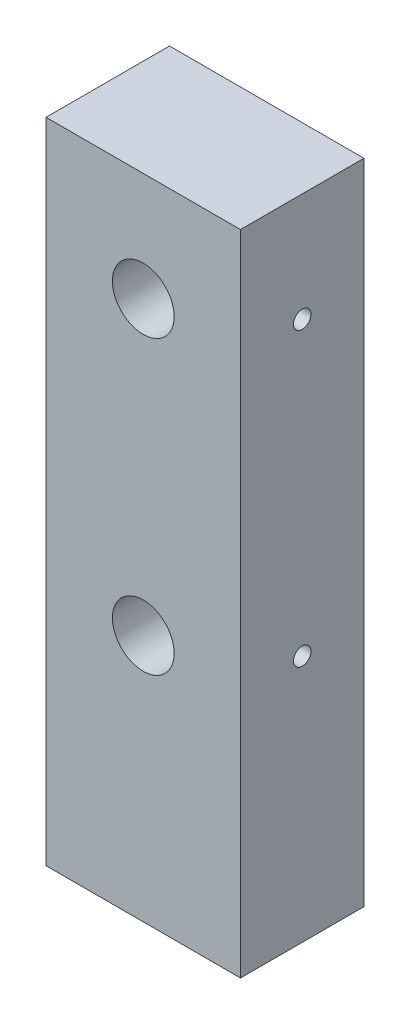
SolidWorks part; units mm, degrees
ref_plane "Front Plane" through (0, 0, 0) normal (0, 0, 1) x (1, 0, 0)
ref_plane "Top Plane" through (0, 0, 0) normal (0, 1, 0) x (1, 0, 0)
ref_plane "Right Plane" through (0, 0, 0) normal (1, 0, 0) x (0, 0, -1)
sketch "Sketch1" plane through (0, 0, 0) normal (0, 1, 0) x (1, 0, 0)
  line L1 (-15, 9.525) -> (15, 9.525)
  line L2 (-15, 9.525) -> (-15, -9.525)
  line L3 (-15, -9.525) -> (15, -9.525)
  line L4 (15, 9.525) -> (15, -9.525)
  line L5 (-15, 9.525) -> (15, -9.525) construction
  line L6 (-15, -9.525) -> (15, 9.525) construction
  point P0 (0, 0)
  dimension "D1" = 19.05
  dimension "D2" = 30
extrude "Boss-Extrude1" add sketch "Sketch1" along normal blind 100
hole_wizard "M5x0.8 Tapped Hole1" positions "Sketch3" profile "Sketch2" tap size "M5x0.8" standard "Ansi Metric"
sketch "Sketch3" plane through (0, 0, 0) normal (0, -1, 0) x (1, 0, 0)
  point P0 (-10, 0)
  point P1 (10, 0)
  dimension "D1" = 10
  dimension "D2" = 10
sketch "Sketch2" plane through (-10, 0, 0) normal (1, 0, 0) x (0, 0, -1)
  line L0 (0, 0) -> (0, 13.6618)
  line L1 (0, 13.6618) -> (2.1, 12.4)
  line L2 (2.1, 12.4) -> (2.1, 0)
  line L5 (2.1, 0) -> (0, 0)
  line L10 (0, 13.6618) -> (-2.1, 12.4) construction
  line L11 (0, -6.35) -> (0, 107.95) construction
  dimension "Tap Drill Dia." = 4.2
  dimension "Tap Drill Depth" = 12.4
  dimension "Drill Angle" = 118
sketch "Sketch4" plane through (0, 0, -9.525) normal (0, 0, -1) x (-1, 0, 0)
  circle A0 centre (0, 38.25) radius 4.7625
  circle A1 centre (0, 83.25) radius 4.7625
  dimension "D2" = 9.525
  dimension "D1" = 38.25
  dimension "D3" = 45
extrude "Cut-Extrude1" cut sketch "Sketch4" against normal through all
hole_wizard "#6-32 Tapped Hole1" positions "Sketch6" profile "Sketch5" tap size "#6-32" standard "Ansi Inch"
sketch "Sketch6" plane through (15, 0, 0) normal (1, 0, 0) x (0, 0, -1)
  line L0 (-9.525, 0) -> (9.525, 0) construction
  point P0 (0, 38.25)
  point P1 (0, 83.25)
  dimension "D1" = 38.25
  dimension "D2" = 45
sketch "Sketch5" plane through (15, 38.25, 0) normal (0, 1, 0) x (0, 0, -1)
  line L0 (0, 0) -> (0, 10.2375)
  line L1 (0, 10.2375) -> (1.3525, 10.2375)
  line L2 (1.3525, 10.2375) -> (1.3525, 0)
  line L5 (1.3525, 0) -> (0, 0)
  line L11 (0, -6.35) -> (0, 107.95) construction
  dimension "Thru Tap Drill Dia." = 2.7051
  dimension "Thru Tap Drill Depth" = 10.2375
